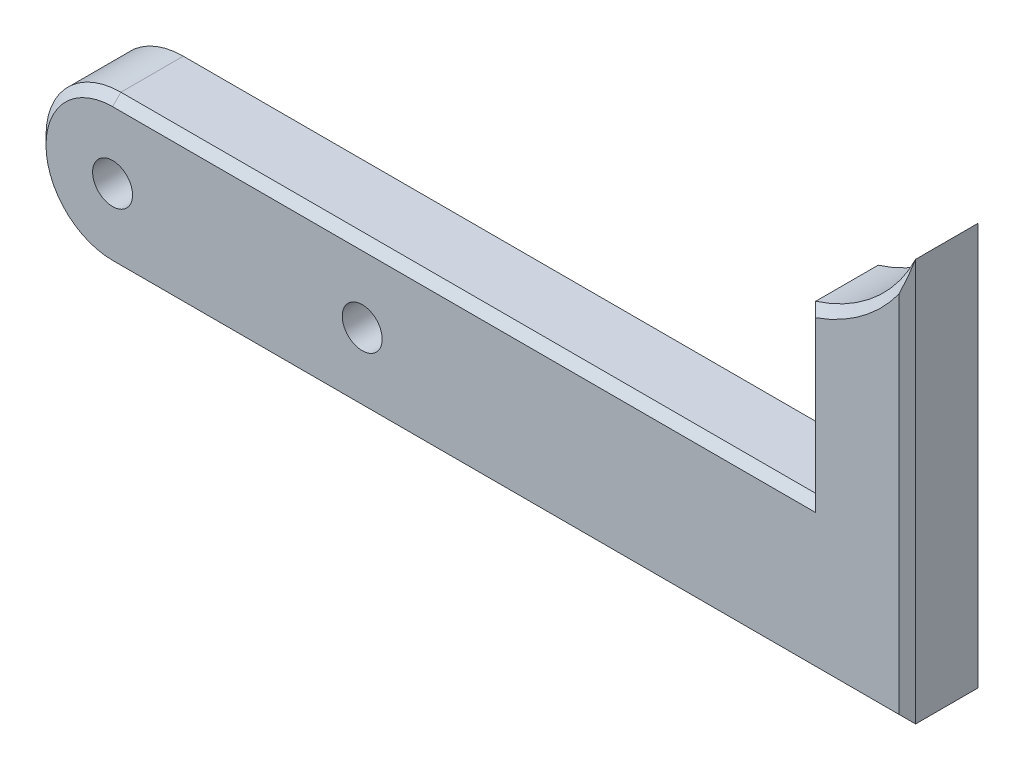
SolidWorks part; units mm, degrees
ref_plane "Front Plane" through (0, 0, 0) normal (0, 0, 1) x (1, 0, 0)
ref_plane "Top Plane" through (0, 0, 0) normal (0, 1, 0) x (1, 0, 0)
ref_plane "Right Plane" through (0, 0, 0) normal (1, 0, 0) x (0, 0, -1)
sketch "Sketch1" plane through (0, 0, 0) normal (0, 0, 1) x (1, 0, 0)
  line L13 (102.5, 48) -> (102.5, 28)
  line L14 (10, 28) -> (102.5, 28)
  line L15 (10, 28) -> (10, 10)
  line L16 (10, 10) -> (114.5, 10)
  line L18 (114.5, 58.361) -> (114.5, 10)
  circle A1 centre (19, 19) radius 2.4
  arc A2 (102.5, 48) -> (114.5, 58.361) centre (96.5, 67.0788) ccw
  circle A3 centre (49, 19) radius 2.4
  point P8 (10, 19)
  dimension "D1" = 4.8
  dimension "D3" = 20
  dimension "D8" = 4.8
  dimension "D2" = 9
  dimension "D4" = 18
  dimension "D5" = 12
  dimension "D6" = 104.5
  dimension "D7" = 6
  dimension "D9" = 30
  dimension "D10" = 10
  dimension "D11" = 10
  dimension "D12" = 20
extrude "Boss-Extrude1" add sketch "Sketch1" along normal mid plane 9.5
fillet "Fillet1" radius 9 2 edges at (10, 10, 0) (10, 28, 0)
chamfer "Chamfer1" distance 1 angle 45 14 edges at (66.75, 10, -4.75) (12.636, 12.636, -4.75) (12.636, 25.364, -4.75) (114.5, 34.1805, -4.75) (109.5705, 51.9407, -4.75) (102.5, 38, -4.75) (60.75, 28, -4.75) (66.75, 10, 4.75) (12.636, 12.636, 4.75) (12.636, 25.364, 4.75) (114.5, 34.1805, 4.75) (109.5705, 51.9407, 4.75) (102.5, 38, 4.75) (60.75, 28, 4.75)
